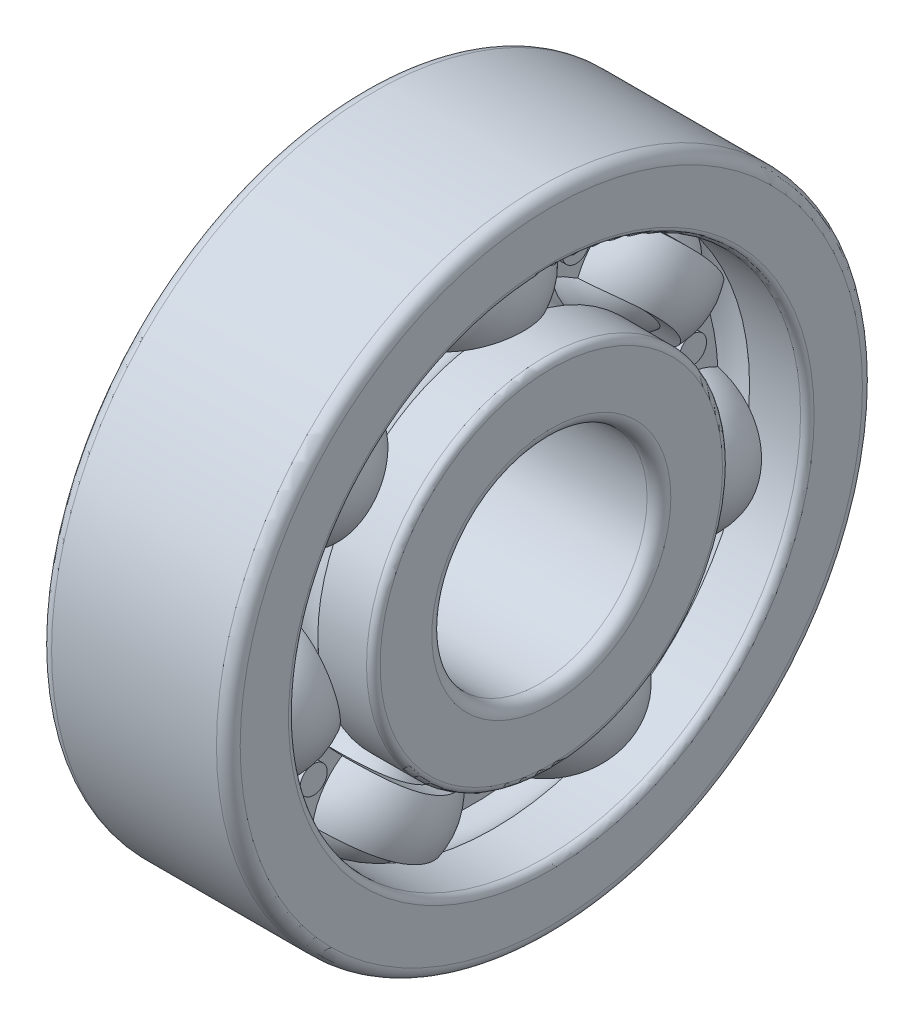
SolidWorks part; units mm, degrees
ref_plane "Front Plane" through (0, 0, 0) normal (0, 0, 1) x (1, 0, 0)
ref_plane "Top Plane" through (0, 0, 0) normal (0, 1, 0) x (1, 0, 0)
ref_plane "Right Plane" through (0, 0, 0) normal (1, 0, 0) x (0, 0, -1)
sketch "Sketch1" plane through (0, 0, 0) normal (1, 0, 0) x (0, 0, -1)
  line L0 (0, 3.175) -> (0, 9.525) construction
  circle A0 centre (0, 0) radius 3.175
  circle A1 centre (0, 0) radius 9.525
  circle A2 centre (0, 6.35) radius 1.6 construction
  circle A3 centre (0, 0) radius 7.55
  circle A4 centre (0, 0) radius 5.25
  dimension "D1" = 6.35
  dimension "D2" = 19.05
  dimension "D3" = 3.2
  dimension "D4" = 10.5
  dimension "D5" = 15.1
extrude "Boss-Extrude1" add sketch "Sketch1" along normal mid plane 5.5626 contours A4 A0 | A1 A3
fillet "Fillet1" radius 0.35 2 edges at (-2.7813, 0, -9.525) (2.7813, 0, -9.525)
fillet "Fillet2" radius 0.35 2 edges at (-2.7813, 0, -3.175) (2.7813, 0, -3.175)
sketch "Sketch2" plane through (0, 0, 0) normal (0, 0, 1) x (1, 0, 0)
  line L0 (0, -7.55) -> (0, 7.55) construction
  line L1 (0, 0) -> (-3.5757, 0) construction
  circle A0 centre (0, 6.3675) radius 1.6
  dimension "D1" = 3.2
revolve "Cut-Revolve1" cut sketch "Sketch2" angle 360 about L1
sketch "Sketch3" plane through (0, 0, 0) normal (1, 0, 0) x (0, 0, -1)
  line L0 (0, 3.175) -> (0, 9.525) construction
  line L1 (0, 4.75) -> (0, 7.95)
  arc A0 (0, 7.95) -> (0, 4.75) centre (0, 6.35) ccw
revolve "Revolve1" add sketch "Sketch3" angle 360 about L1
pattern_circular "CirPattern1" count 7 over 360 about axis through (0, 0, 0) along (1, 0, 0)
fillet "Fillet3" radius 0.2 2 edges at (-2.7813, 0, -7.55) (2.7813, 0, -7.55)
fillet "Fillet4" radius 0.2 2 edges at (2.7813, 0, -5.25) (-2.7813, 0, -5.25)
sketch "Sketch4" plane through (0, 0, 0) normal (1, 0, 0) x (0, 0, -1)
  circle A0 centre (0, 0) radius 7.2
  circle A1 centre (0, 0) radius 5.6
  dimension "D1" = 14.4
  dimension "D2" = 11.2
extrude "Boss-Extrude2" add sketch "Sketch4" along normal blind 2.1 separate body
sketch "Sketch5" plane through (0, 0, 0) normal (-1, 0, 0) x (0, 0, 1)
  line L0 (0, 3.175) -> (0, 9.525) construction
  line L1 (0, 4.75) -> (0, 7.95)
  circle A0 centre (0, 6.35) radius 1.6 construction
  arc A1 (0, 7.95) -> (0, 4.75) centre (0, 6.35) ccw
revolve "Cut-Revolve2" cut sketch "Sketch5" angle 360 about L1
pattern_circular "CirPattern2" count 7 over 360 about axis through (0, 0, 0) along (1, 0, 0) of "Cut-Revolve2"
shell "Shell1" thickness 0.5
mirror "Mirror1" about plane through (0, 0, 0) normal (1, 0, 0) of "Shell1"
mirror "Mirror2" about plane through (0, 0, 0) normal (1, 0, 0)
sketch "Sketch6" plane through (-0.5, 0, 0) normal (-1, 0, 0) x (0, 0, 1)
  circle A0 centre (0, -6.3675) radius 0.25
  circle A1 centre (-4.9783, -3.9701) radius 0.25
  circle A2 centre (-6.2078, 1.4169) radius 0.25
  circle A3 centre (-2.7627, 5.7369) radius 0.25
  circle A4 centre (2.7627, 5.7369) radius 0.25
  circle A5 centre (6.2078, 1.4169) radius 0.25
  circle A6 centre (4.9783, -3.9701) radius 0.25
  point P17 (0, 0)
  dimension "D1" = 7
extrude "Cut-Extrude1" cut sketch "Sketch6" against normal blind 2.1
sketch "Sketch7" plane through (-0.5, 0, 0) normal (-1, 0, 0) x (0, 0, 1)
  circle A0 centre (0, -6.3675) radius 0.4
  circle A1 centre (-4.9783, -3.9701) radius 0.4
  circle A2 centre (-6.2078, 1.4169) radius 0.4
  circle A3 centre (-2.7627, 5.7369) radius 0.4
  circle A4 centre (2.7627, 5.7369) radius 0.4
  circle A5 centre (6.2078, 1.4169) radius 0.4
  circle A6 centre (4.9783, -3.9701) radius 0.4
  point P18 (0, 0)
  dimension "D1" = 0.8
  dimension "D2" = 7
extrude "Boss-Extrude3" add sketch "Sketch7" along normal blind 0.25
mirror "Mirror3" about plane through (0, 0, 0) normal (1, 0, 0) of "Boss-Extrude3"
sketch "Sketch8" plane through (0.5, 0, 0) normal (1, 0, 0) x (0, 0, -1)
  circle A0 centre (0, -6.3675) radius 0.4
  arc A1 (0.7225, -5.5532) -> (1.2446, -7.0916) centre (2.7552, -5.7212) ccw construction
  circle A2 centre (-4.9783, -3.9701) radius 0.4
  circle A3 centre (-6.2078, 1.4169) radius 0.4
  circle A4 centre (-2.7627, 5.7369) radius 0.4
  circle A5 centre (2.7627, 5.7369) radius 0.4
  circle A6 centre (6.2078, 1.4169) radius 0.4
  circle A7 centre (4.9783, -3.9701) radius 0.4
  point P3 (0.8238, -6.3766)
  point P22 (0, 0)
  dimension "D1" = 0.8
  dimension "D2" = 7
extrude "Boss-Extrude4" add sketch "Sketch8" along normal blind 0.25
